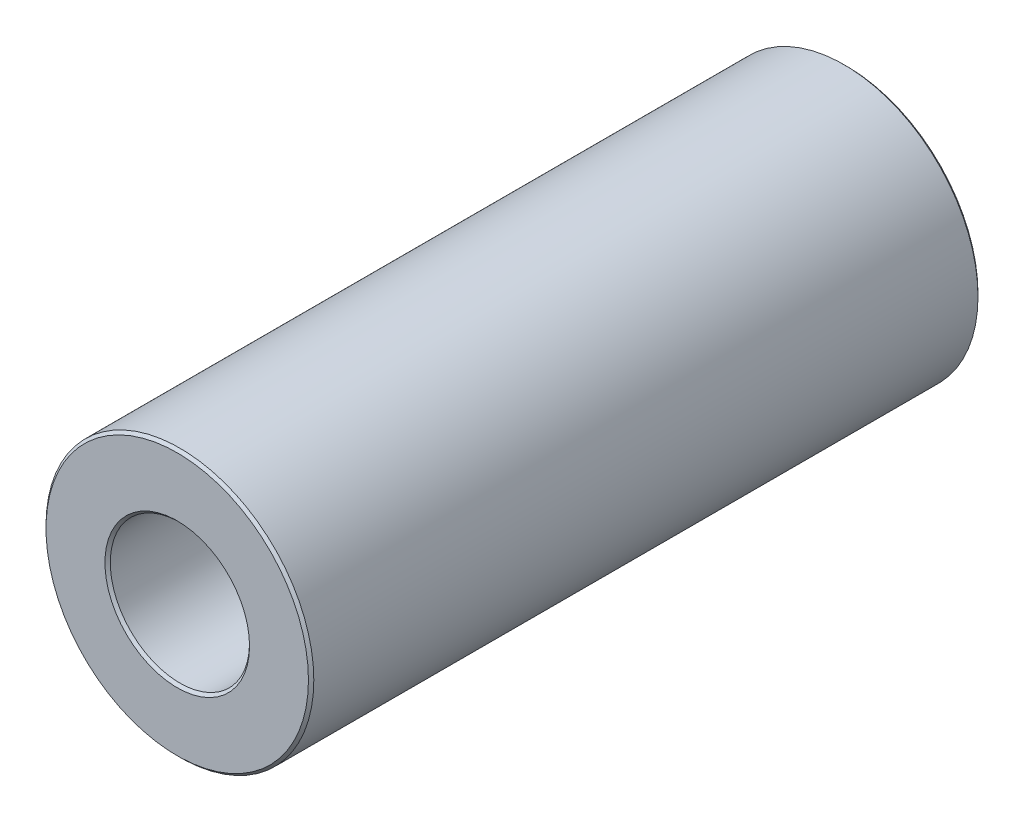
SolidWorks part; units mm, degrees
ref_plane "Front Plane" through (0, 0, 0) normal (0, 0, 1) x (1, 0, 0)
ref_plane "Top Plane" through (0, 0, 0) normal (0, 1, 0) x (1, 0, 0)
ref_plane "Right Plane" through (0, 0, 0) normal (1, 0, 0) x (0, 0, -1)
sketch "Sketch1" plane through (0, 0, 0) normal (0, 0, 1) x (1, 0, 0)
  circle A0 centre (0, 0) radius 5
  circle A1 centre (0, 0) radius 2.6
  dimension "D1" = 10
  dimension "D2" = 5.2
extrude "Boss-Extrude2" add sketch "Sketch1" along normal mid plane 25
chamfer "Chamfer3" distance 0.1 angle 45 4 edges at (5, 0, 12.5) (5, 0, -12.5) (2.6, 0, -12.5) (2.6, 0, 12.5)
